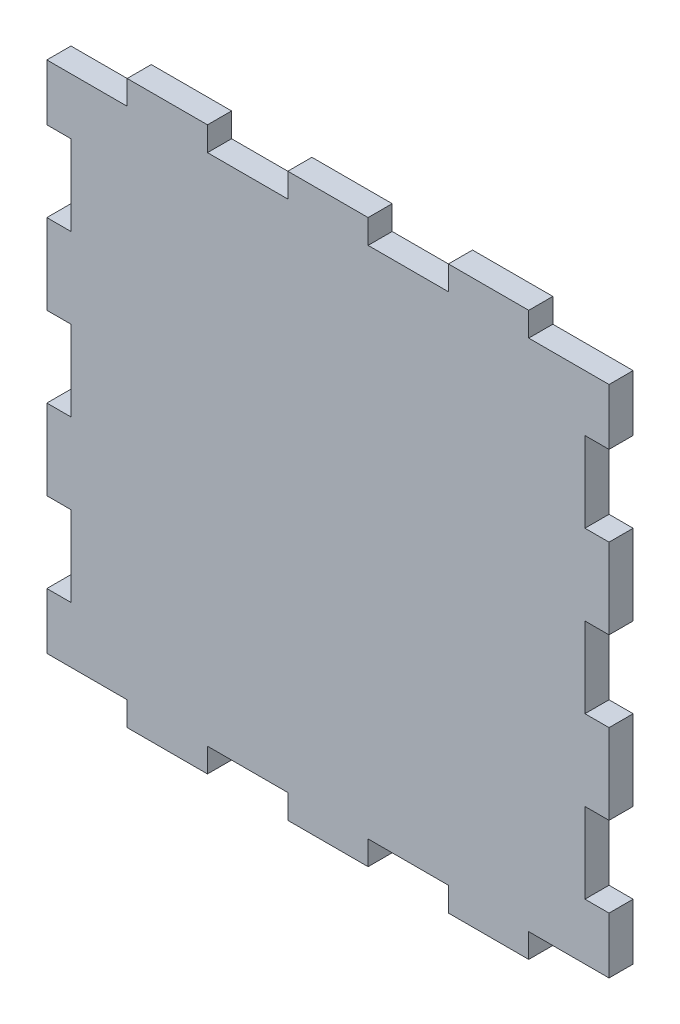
SolidWorks part; units mm, degrees
ref_plane "Front Plane" through (0, 0, 0) normal (0, 0, 1) x (1, 0, 0)
ref_plane "Top Plane" through (0, 0, 0) normal (0, 1, 0) x (1, 0, 0)
ref_plane "Right Plane" through (0, 0, 0) normal (1, 0, 0) x (0, 0, -1)
sketch "Sketch1" plane through (0, 0, 0) normal (0, 0, 1) x (1, 0, 0)
  line L1 (35, 35) -> (-35, 35)
  line L2 (35, 35) -> (35, -35)
  line L3 (35, -35) -> (-35, -35)
  line L4 (-35, 35) -> (-35, -35)
  line L5 (35, 35) -> (-35, -35) construction
  line L6 (35, -35) -> (-35, 35) construction
  point P0 (0, 0)
extrude "Boss-Extrude1" add sketch "Sketch1" along normal blind 3
sketch "Sketch2" plane through (0, 0, 0) normal (0, 0, -1) x (-1, 0, 0)
  line L0 (-15, 32) -> (-5, 32)
  line L1 (-35, 35) -> (-25, 35)
  line L2 (-35, 35) -> (-35, 32)
  line L3 (-35, 32) -> (-25, 32)
  line L4 (-25, 35) -> (-25, 32)
  line L5 (-35, 35) -> (-25, 32) construction
  line L6 (-35, 32) -> (-25, 35) construction
  line L7 (-5, 35) -> (-5, 32)
  line L8 (-15, 35) -> (-5, 35)
  line L9 (-15, 35) -> (-15, 32)
  line L10 (5, 32) -> (15, 32)
  line L11 (15, 35) -> (15, 32)
  line L12 (5, 35) -> (15, 35)
  line L13 (5, 35) -> (5, 32)
  line L14 (25, 32) -> (35, 32)
  line L15 (35, 35) -> (35, 32)
  line L16 (25, 35) -> (35, 35)
  line L17 (25, 35) -> (25, 32)
  line L18 (-35, 32) -> (-15, 32) construction
  point P4 (-30, 33.5)
extrude "Cut-Extrude1" cut sketch "Sketch2" against normal blind 3
sketch "Sketch3" plane through (0, 0, 0) normal (0, 0, -1) x (-1, 0, 0)
  line L0 (-15, -32) -> (-5, -32)
  line L1 (-35, -35) -> (-25, -35)
  line L2 (-35, -35) -> (-35, -32)
  line L3 (-35, -32) -> (-25, -32)
  line L4 (-25, -35) -> (-25, -32)
  line L5 (-35, -35) -> (-25, -32) construction
  line L6 (-35, -32) -> (-25, -35) construction
  line L7 (-5, -35) -> (-5, -32)
  line L8 (-15, -35) -> (-5, -35)
  line L9 (-15, -35) -> (-15, -32)
  line L10 (5, -32) -> (15, -32)
  line L11 (15, -35) -> (15, -32)
  line L12 (5, -35) -> (15, -35)
  line L13 (5, -35) -> (5, -32)
  line L14 (25, -32) -> (35, -32)
  line L15 (35, -35) -> (35, -32)
  line L16 (25, -35) -> (35, -35)
  line L17 (25, -35) -> (25, -32)
  line L18 (-35, -32) -> (-15, -32) construction
  point P4 (-30, -33.5)
extrude "Cut-Extrude2" cut sketch "Sketch3" against normal blind 3
sketch "Sketch4" plane through (0, 0, 0) normal (0, 0, -1) x (-1, 0, 0)
  line L0 (-35, -32) -> (-35, 32) construction
  line L1 (-35, 25) -> (-32, 25)
  line L2 (-35, 25) -> (-35, 15)
  line L3 (-35, 15) -> (-32, 15)
  line L4 (-32, 25) -> (-32, 15)
  line L5 (-35, 25) -> (-32, 15) construction
  line L6 (-35, 15) -> (-32, 25) construction
  line L7 (-32, 5) -> (-32, -5)
  line L8 (-35, 5) -> (-35, -5)
  line L9 (-35, 5) -> (-32, 5)
  line L10 (-35, -5) -> (-32, -5)
  line L11 (-32, -15) -> (-32, -25)
  line L12 (-35, -15) -> (-35, -25)
  line L13 (-35, -15) -> (-32, -15)
  line L14 (-35, -25) -> (-32, -25)
  line L15 (-32, 25) -> (-32, 5) construction
  point P4 (-33.5, 20)
  point P8 (-32, 20)
extrude "Cut-Extrude3" cut sketch "Sketch4" against normal blind 3
sketch "Sketch5" plane through (0, 0, 0) normal (0, 0, -1) x (-1, 0, 0)
  line L0 (35, 32) -> (35, -32) construction
  line L1 (35, 25) -> (32, 25)
  line L2 (35, 25) -> (35, 15)
  line L3 (35, 15) -> (32, 15)
  line L4 (32, 25) -> (32, 15)
  line L5 (35, 25) -> (32, 15) construction
  line L6 (35, 15) -> (32, 25) construction
  line L7 (32, 5) -> (32, -5)
  line L8 (35, 5) -> (32, 5)
  line L9 (35, 5) -> (35, -5)
  line L10 (35, -5) -> (32, -5)
  line L11 (32, -15) -> (32, -25)
  line L12 (35, -15) -> (32, -15)
  line L13 (35, -15) -> (35, -25)
  line L14 (35, -25) -> (32, -25)
  line L15 (32, 25) -> (32, 5) construction
  point P4 (33.5, 20)
  point P7 (33.5, 25)
extrude "Cut-Extrude4" cut sketch "Sketch5" against normal blind 3
equation "\"length\"= 70mm"
equation "\"width\"= \"length\""
equation "\"height\"= 3mm"
equation "\"finger\" = 10mm"
equation "\"finger_w\"= \"height\""
equation "\"D1@Sketch1\"=\"length\""
equation "\"D2@Sketch1\"=\"width\""
equation "\"D1@Boss-Extrude1\"=\"height\""
equation "\"D2@Sketch2\"=\"finger_w\""
equation "\"D1@Cut-Extrude1\"=\"height\""
equation "\"D1@Sketch3\"=\"finger\""
equation "\"D2@Sketch3\"=\"finger_w\""
equation "\"D1@Cut-Extrude2\"=\"height\""
equation "\"D1@Sketch4\"=\"finger_w\""
equation "\"D2@Sketch4\"=\"finger\""
equation "\"D1@Cut-Extrude3\"=\"height\""
equation "\"D1@Sketch5\"=\"finger_w\""
equation "\"D2@Sketch5\"=\"finger\""
equation "\"D1@Cut-Extrude4\"=\"height\""
